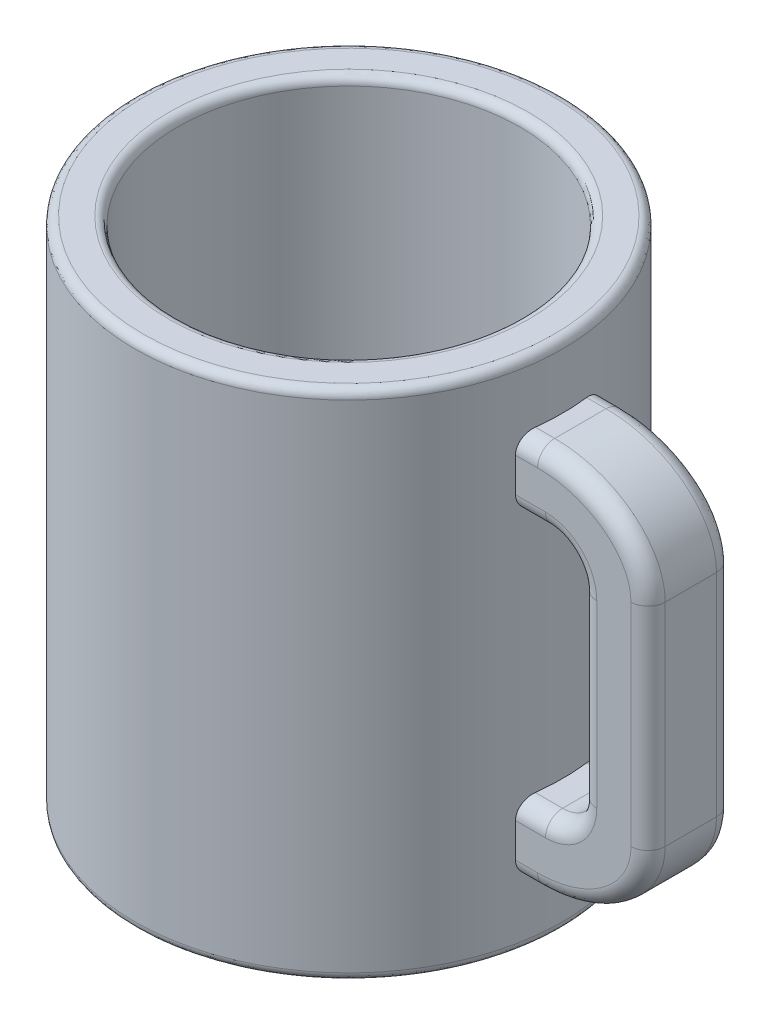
SolidWorks part; units mm, degrees
ref_plane "Front Plane" through (0, 0, 0) normal (0, 0, 1) x (1, 0, 0)
ref_plane "Top Plane" through (0, 0, 0) normal (0, 1, 0) x (1, 0, 0)
ref_plane "Right Plane" through (0, 0, 0) normal (1, 0, 0) x (0, 0, -1)
sketch "Sketch1" plane through (0, 0, 0) normal (0, 0, 1) x (1, 0, 0)
  line L0 (-196.7386, -654.5826) -> (-179.6575, -654.5826)
  line L1 (-166.7402, -664.7104) -> (-166.7402, -689.4548)
  line L2 (-179.6575, -699.5826) -> (-196.7386, -699.5826)
  line L3 (-196.7386, -699.5826) -> (-196.7402, -699.5826)
  line L4 (-191.8092, -692.1053) -> (-191.8092, -662.0599)
  line L5 (-196.7402, -654.5826) -> (-196.7386, -654.5826)
  line L6 (-230.7401, -647.0826) -> (-206.7402, -647.0826)
  line L8 (-206.7402, -707.0826) -> (-230.7401, -707.0826)
  line L9 (-231.7402, -706.0825) -> (-231.7402, -648.0825)
  line L10 (-206.7402, -647.0826) -> (-206.7402, -707.0826)
  spline S0 degree 3 poles (-179.6575, -654.5826) (-172.553, -654.5826) (-166.7402, -659.1401) (-166.7402, -664.7104) knots 0.1 0.1 0.1 0.1 0.2 0.2 0.2 0.2
  spline S1 degree 3 poles (-166.7402, -689.4548) (-166.7402, -695.0251) (-172.553, -699.5826) (-179.6575, -699.5826) knots 0.3 0.3 0.3 0.3 0.4 0.4 0.4 0.4
  spline S2 degree 3 poles (-196.7402, -699.5826) (-194.7871, -697.2446) (-193.1297, -694.7414) (-191.8092, -692.1053) knots 0.6 0.6 0.6 0.6 0.7 0.7 0.7 0.7
  spline S3 degree 3 poles (-191.8092, -662.0599) (-193.1297, -659.4238) (-194.7871, -656.9206) (-196.7402, -654.5826) knots 0.8 0.8 0.8 0.8 0.9 0.9 0.9 0.9
  spline S6 degree 3 poles (-230.7401, -707.0826) (-231.2902, -707.0826) (-231.7402, -706.6326) (-231.7402, -706.0825) knots 0.625 0.625 0.625 0.625 0.75 0.75 0.75 0.75
  spline S7 degree 3 poles (-231.7402, -648.0825) (-231.7402, -647.5326) (-231.2902, -647.0826) (-230.7401, -647.0826) knots 0.875 0.875 0.875 0.875 1 1 1 1
revolve "Revolve1" add sketch "Sketch1" angle 360 about L10
sketch "Sketch2" plane through (0, 0, 0) normal (0, 0, 1) x (1, 0, 0)
  line L0 (-196.7386, -654.5826) -> (-179.6575, -654.5826) construction
  line L1 (-196.7402, -654.5826) -> (-196.7386, -654.5826) construction
  line L2 (-184.1197, -654.5826) -> (-184.1197, -662.5826) construction
  line L3 (-196.7386, -699.5826) -> (-196.7402, -699.5826) construction
  line L4 (-179.6575, -699.5826) -> (-196.7386, -699.5826) construction
  line L5 (-166.7402, -664.7104) -> (-166.7402, -689.4548) construction
  line L6 (-184.1197, -654.5826) -> (-179.6575, -654.5826)
  line L7 (-196.7402, -654.5826) -> (-196.7386, -654.5826)
  line L9 (-196.7386, -699.5826) -> (-196.7402, -699.5826)
  line L10 (-179.6575, -699.5826) -> (-184.1197, -699.5826)
  line L11 (-166.7402, -664.7104) -> (-166.7402, -689.4548)
  line L12 (-184.1197, -654.5826) -> (-184.1197, -662.5826)
  line L13 (-184.1197, -699.5826) -> (-184.1197, -691.5826) construction
  line L14 (-166.7402, -677.0826) -> (-174.7402, -677.0826) construction
  line L15 (-184.1197, -662.5826) -> (-178.7402, -662.5826)
  line L16 (-174.7402, -666.5826) -> (-174.7402, -687.5826)
  line L17 (-178.7402, -691.5826) -> (-184.1197, -691.5826)
  line L18 (-184.1197, -691.5826) -> (-184.1197, -699.5826)
  arc A0 (-174.7402, -687.5826) -> (-178.7402, -691.5826) centre (-178.7402, -687.5826) cw
  arc A1 (-174.7402, -666.5826) -> (-178.7402, -662.5826) centre (-178.7402, -666.5826) ccw
  spline S2 degree 3 poles (-2039.0853, -1374.0634) (1581.7804, 387.9839) (-1654.6836, -2122.0675) (871.4342, 990.233) knots -0.336502 -0.336502 -0.336502 -0.336502 1.071502 1.071502 1.071502 1.071502 only from (-166.7402, -689.4548) to (-179.6575, -699.5826) construction
  spline S3 degree 3 poles (871.4426, -2344.4086) (-1654.6882, 767.9046) (1581.7777, -1742.1459) (-2039.074, 19.8927) knots -0.571504 -0.571504 -0.571504 -0.571504 0.836501 0.836501 0.836501 0.836501 only from (-179.6575, -654.5826) to (-166.7402, -664.7104) construction
  spline S6 degree 3 poles (-166.7402, -689.4548) (-166.7402, -695.0251) (-172.553, -699.5826) (-179.6575, -699.5826) knots 0.3 0.3 0.3 0.3 0.4 0.4 0.4 0.4
  spline S7 degree 3 poles (-179.6575, -654.5826) (-172.553, -654.5826) (-166.7402, -659.1401) (-166.7402, -664.7104) knots 0.1 0.1 0.1 0.1 0.2 0.2 0.2 0.2
  dimension "D1" = 4
extrude "Boss-Extrude1" add sketch "Sketch2" along normal mid plane 10 contours S7 L6 L12 L10 S6 L11
shell "Shell1" thickness 5
fillet "Fillet1" radius 1 1 edges at (-206.7402, -647.0826, -20)
fillet "Fillet2" radius 2 20 edges at (-180.9514, -654.5826, -5) (-180.9514, -699.5826, -5) (-166.7402, -677.0826, -5) (-180.9514, -654.5826, 5) (-180.9514, -699.5826, 5) (-166.7402, -677.0826, 5) (-180.4928, -662.5826, -5) (-175.9118, -663.7542, -5) (-174.7402, -677.0826, -5) (-180.4928, -691.5826, -5) (-180.4928, -691.5826, 5) (-175.9118, -690.411, 5) (-174.7402, -677.0826, 5) (-180.4928, -662.5826, 5) (-175.9118, -690.411, -5) (-175.9118, -663.7542, 5)
